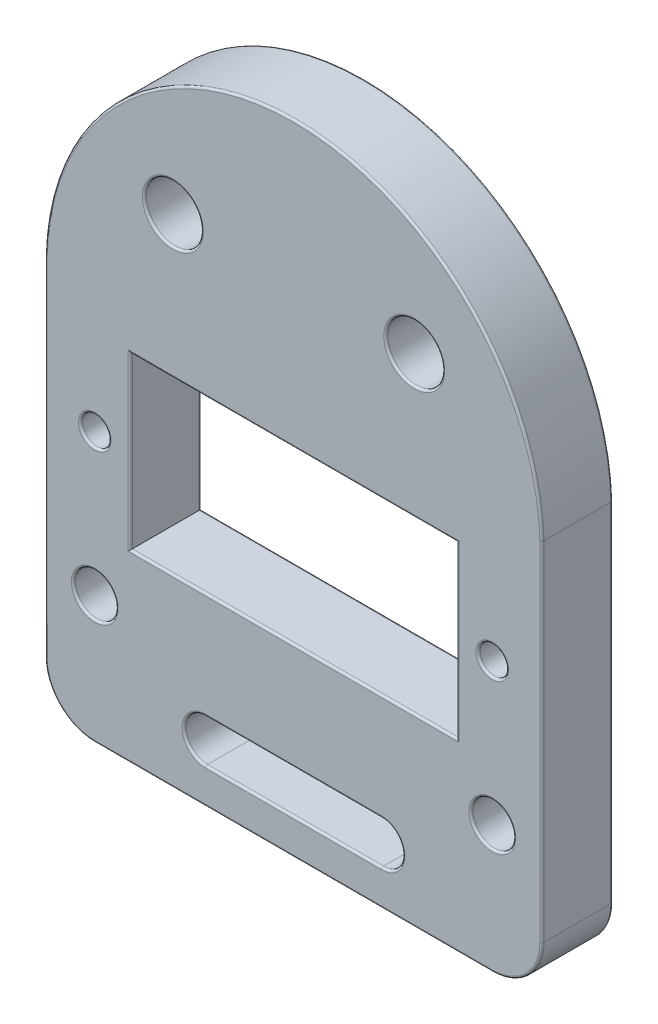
SolidWorks part; units mm, degrees
ref_plane "Front Plane" through (0, 0, 0) normal (0, 0, 1) x (1, 0, 0)
ref_plane "Top Plane" through (0, 0, 0) normal (0, 1, 0) x (1, 0, 0)
ref_plane "Right Plane" through (0, 0, 0) normal (1, 0, 0) x (0, 0, -1)
sketch "Sketch1" plane through (0, 0, 0) normal (0, 0, 1) x (1, 0, 0)
  line L0 (0, -19) -> (0, 26) construction
  line L1 (11.5, -6) -> (-11.5, -6)
  line L2 (11.5, -6) -> (11.5, 6)
  line L3 (11.5, 6) -> (-11.5, 6)
  line L4 (-11.5, -6) -> (-11.5, 6)
  line L5 (11.5, -6) -> (-11.5, 6) construction
  line L6 (11.5, 6) -> (-11.5, -6) construction
  line L7 (-6.2, -15) -> (6.2, -15) construction
  line L8 (-6.2, -13.5) -> (6.2, -13.5)
  line L9 (-6.2, -16.5) -> (6.2, -16.5)
  line L11 (-17.5, 9) -> (17.5, 9) construction
  line L12 (-17.5, 9) -> (-17.5, -19)
  line L13 (-17.5, -19) -> (17.5, -19)
  line L14 (17.5, 9) -> (17.5, -19)
  circle A0 centre (-14, 0) radius 1
  circle A1 centre (-14, -10) radius 1.5
  arc A2 (-6.2, -13.5) -> (-6.2, -16.5) centre (-6.2, -15) ccw
  arc A3 (6.2, -16.5) -> (6.2, -13.5) centre (6.2, -15) ccw
  circle A4 centre (-8.5, 16) radius 2
  circle A5 centre (14, -10) radius 1.5
  circle A6 centre (14, 0) radius 1
  circle A7 centre (8.5, 16) radius 2
  arc A8 (-17.5, 9) -> (17.5, 9) centre (0, 8.4926) cw
  point P0 (0, 0)
  point P10 (-11.5, 0)
  point P11 (0, -15)
  point P33 (0, 26)
  dimension "D5" = 2
  dimension "D7" = 3
  dimension "D9" = 1.5
  dimension "D12" = 10
  dimension "D13" = 4
  dimension "D1" = 23
  dimension "D2" = 12
  dimension "D3" = 45
  dimension "D4" = 13
  dimension "D6" = 2.5
  dimension "D8" = 10
  dimension "D10" = 12.4
  dimension "D11" = 4
  dimension "D14" = 8.5
  dimension "D15" = 28
  dimension "D16" = 35
  dimension "D17" = 13
extrude "Boss-Extrude1" add sketch "Sketch1" along normal blind 5
fillet "Fillet1" radius 3.5 2 edges at (17.5, -19, 2.5) (-17.5, -19, 2.5)
fillet "Fillet2" radius 0.15 40 edges at (6.5, 16, 0) (12.5, -10, 0) (7.7, -15, 0) (0, -16.5, 0) (-7.7, -15, 0) (0, -13.5, 0) (-12.5, -10, 0) (11.5, 0, 0) (0, -6, 0) (-11.5, 0, 0) (0, 6, 0) (0, 26, 0) (-17.5, -3.25, 0) (-16.4749, -17.9749, 0) (0, -19, 0) (16.4749, -17.9749, 0) (17.5, -3.25, 0) (-13, 0, 0) (-6.5, 16, 0) (13, 0, 0) (6.5, 16, 5) (13, 0, 5) (12.5, -10, 5) (-6.5, 16, 5) (0, -16.5, 5) (7.7, -15, 5) (0, -13.5, 5) (-7.7, -15, 5) (-16.4749, -17.9749, 5) (-17.5, -3.25, 5) (0, 26, 5) (17.5, -3.25, 5) (16.4749, -17.9749, 5) (0, -19, 5) (0, -6, 5) (11.5, 0, 5) (0, 6, 5) (-11.5, 0, 5) (-13, 0, 5) (-12.5, -10, 5)
